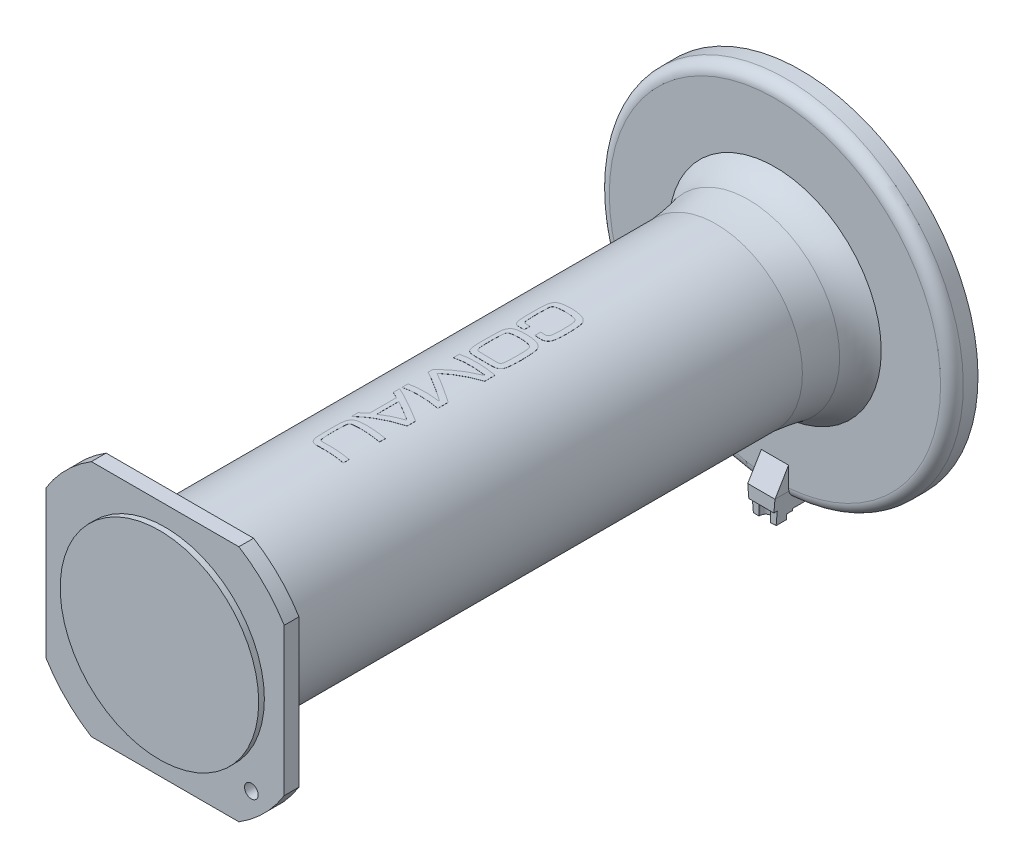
SolidWorks part; units mm, degrees
ref_plane "Piano1 (Front/Back)" through (0, 0, 0) normal (0, 0, 1) x (1, 0, 0)
ref_plane "Piano2 (Top/Bottom)" through (0, 0, 0) normal (0, 1, 0) x (1, 0, 0)
ref_plane "Piano3 (Left/Right)" through (0, 0, 0) normal (1, 0, 0) x (0, 0, -1)
imported_body "Importato1"
sketch "Schizzo1" plane through (0, 0, 0) normal (0, 1, 0) x (1, 0, 0)
  line L0 (-15, -420) -> (-15, -200) construction
  line L1 (156, 0) -> (-156, 0) construction
  text T0 "COMAU" font "MicrogrammaDMedExt" height 31.5
  dimension "D1" = 220
  dimension "D2" = 15
  dimension "D3" = 420
extrude "Estrusione1" add sketch "Schizzo1" against normal offset from surface (75.5969 mm away) 0.1
sketch "Schizzo2" plane through (0, 0, 0) normal (0, 1, 0) x (1, 0, 0)
  line L0 (-15, -201.6575) -> (-15, -437.5499) construction
  line L1 (16.5, -201.6575) -> (0.9253, -201.6575) construction
  line L2 (-15, -330.2466) -> (-15, -335.4247) construction
  text T0 "COMAU" font "MicrogrammaDMedExt" height 31.5
extrude "Estrusione2" add sketch "Schizzo2" along normal offset from surface (75.5969 mm away) 0.1
